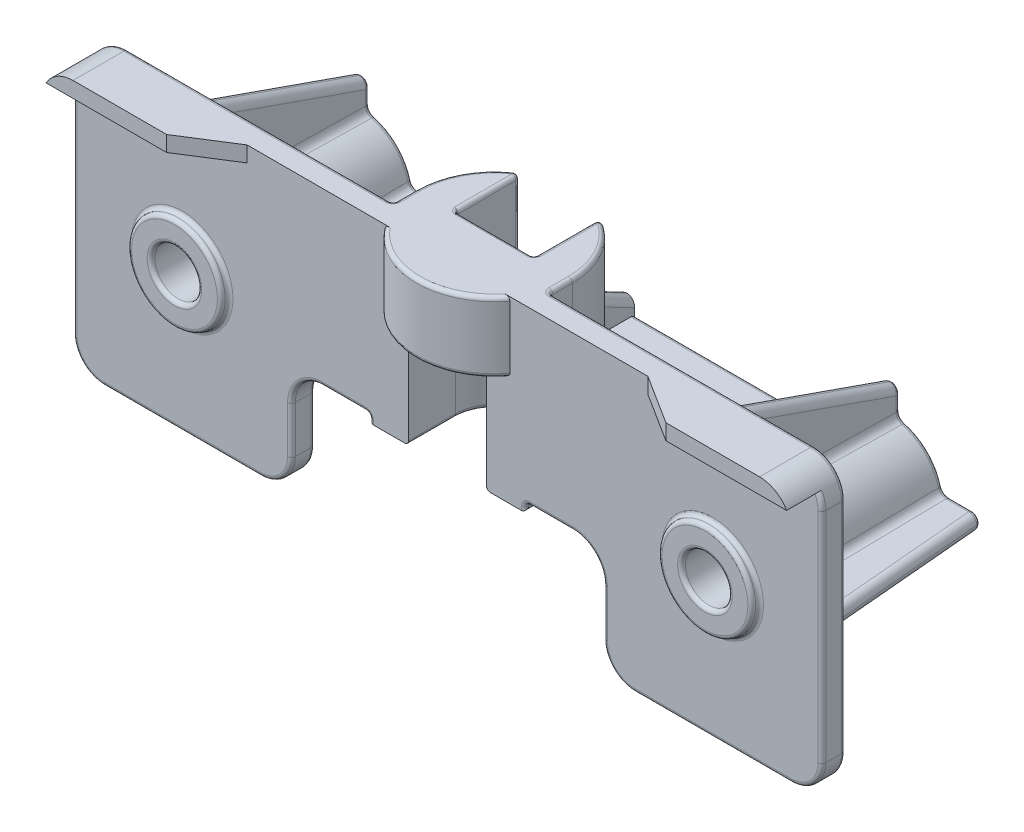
SolidWorks part; units mm, degrees
ref_plane "Face" through (0, 0, 0) normal (0, 0, 1) x (1, 0, 0)
ref_plane "Dessus" through (0, 0, 0) normal (0, 1, 0) x (1, 0, 0)
ref_plane "Droite" through (0, 0, 0) normal (1, 0, 0) x (0, 0, -1)
sketch "Esquisse1" plane through (0, 0, 0) normal (0, 0, 1) x (1, 0, 0)
  line L0 (0, 49.8635) -> (0, -37.2664) construction
  line L1 (-22, 9) -> (22, 9)
  line L2 (12, -9) -> (22, -9)
  line L6 (-24, 7) -> (-24, -7)
  line L7 (24, 7) -> (24, -7)
  line L8 (-22, -9) -> (-12, -9)
  line L9 (0, 0) -> (46.9803, 0) construction
  line L10 (10, -4) -> (10, -7)
  line L11 (-10, -4) -> (-10, -7)
  line L12 (8, -2) -> (-8, -2)
  arc A0 (-24, 7) -> (-22, 9) centre (-22, 7) cw
  arc A5 (24, 7) -> (22, 9) centre (22, 7) ccw
  arc A6 (22, -9) -> (24, -7) centre (22, -7) ccw
  arc A7 (-24, -7) -> (-22, -9) centre (-22, -7) ccw
  arc A8 (10, -7) -> (12, -9) centre (12, -7) ccw
  arc A9 (10, -4) -> (8, -2) centre (8, -4) ccw
  arc A10 (-8, -2) -> (-10, -4) centre (-8, -4) ccw
  arc A11 (-12, -9) -> (-10, -7) centre (-12, -7) ccw
  point P13 (0, -9)
  point P15 (-24, 9)
  point P30 (24, 9)
  point P33 (24, -9)
  point P36 (-24, -9)
  point P51 (0, -2)
  dimension "D6" = 2
  dimension "D2" = 48
  dimension "D3" = 9
  dimension "D4" = 18
extrude "Extrusion1" add sketch "Esquisse1" along normal blind 1.5
sketch "Esquisse2" plane through (0, 0, 0) normal (0, 1, 0) x (1, 0, 0)
  line L0 (-23.5, 0) -> (23.5, 0)
  line L1 (0, 0) -> (0, 12.9762) construction
  line L2 (-23.5, 0) -> (-22.6251, 10)
  line L3 (23.5, 0) -> (22.6251, 10)
  line L4 (-22.6251, 10) -> (22.6251, 10)
  point P10 (0, 10)
  dimension "D1" = 10
  dimension "D2" = 5
  dimension "D3" = 23.5
extrude "Extrusion2" add sketch "Esquisse2" along normal mid plane 1
sketch "Esquisse3" plane through (0, 0, 0) normal (0, 0, -1) x (-1, 0, 0)
  line L0 (0, 0) -> (-28.9554, 0) construction
  line L1 (0, 0) -> (0, 13.9934) construction
  circle A0 centre (-17, 0) radius 3.5
  circle A1 centre (17, 0) radius 3.5
  dimension "D1" = 7
  dimension "D2" = 34
extrude "Extrusion3" add sketch "Esquisse3" along normal up to surface draft 1
sketch "Esquisse4" plane through (0, 0, 1.5) normal (0, 0, 1) x (1, 0, 0)
  line L4 (-16, 9) -> (-16, 8)
  line L5 (22, 9) -> (16, 9)
  line L6 (0, 0) -> (0, 16.398) construction
  line L7 (-16, 9) -> (-22, 9)
  line L8 (23.7321, 8) -> (16, 8)
  line L9 (16, 9) -> (16, 8)
  line L11 (-16, 8) -> (-23.7321, 8)
  arc A2 (23.7321, 8) -> (22, 9) centre (22, 7) ccw
  arc A3 (-22, 9) -> (-23.7321, 8) centre (-22, 7) ccw
  dimension "D2" = 16
  dimension "D3" = 32
  dimension "D1" = 1
extrude "Extrusion4" add sketch "Esquisse4" along normal blind 2
sketch "Esquisse5" plane through (0, 8, 0) normal (0, -1, 0) x (1, 0, 0)
  line L0 (16, 3.5) -> (12.8407, 1.5)
  line L2 (12.8407, 1.5) -> (16, 1.5)
  line L3 (16, 1.5) -> (16, 3.5)
  line L4 (0, 0) -> (0, 14.2244) construction
  line L5 (-16, 1.5) -> (-16, 3.5)
  line L6 (-12.8407, 1.5) -> (-16, 1.5)
  line L7 (-16, 3.5) -> (-12.8407, 1.5)
extrude "Extrusion6" add sketch "Esquisse5" against normal up to surface (1 mm away)
sketch "Esquisse6" plane through (0, 9, 0) normal (0, 1, 0) x (-1, 0, 0)
  line L0 (-12.8407, 1.5) -> (12.8407, 1.5) construction
  line L1 (0, 0) -> (0, -14.3045) construction
  line L2 (-7.1136, -1.5) -> (7.1804, -1.5) construction
  line L4 (4, 1.5) -> (5, 1.5)
  line L5 (5, -1.5) -> (5, 1.5)
  line L6 (-5, -1.5) -> (-5, 1.5)
  line L8 (-5, 1.5) -> (-4, 1.5)
  arc A0 (-5, -1.5) -> (5, -1.5) centre (0, -1.5) ccw
  arc A1 (4, 1.5) -> (-4, 1.5) centre (0, -1.5) ccw
  dimension "D1" = 10
  dimension "D2" = 3
extrude "Extrusion7" add sketch "Esquisse6" against normal blind 11.5
sketch "Esquisse7" plane through (0, -2.5, 0) normal (0, -1, 0) x (1, 0, 0)
  line L0 (5, 1.5) -> (8, 1.5) construction
  line L1 (-7.5812, 6.8026) -> (7.1804, 6.8026)
  line L2 (-7.5812, 6.8026) -> (-7.5812, 1.5)
  line L3 (-7.5812, 1.5) -> (7.1804, 1.5)
  line L4 (7.1804, 6.8026) -> (7.1804, 1.5)
extrude "Enlèv. mat.-Extru.1" cut sketch "Esquisse7" against normal blind 7
sketch "Esquisse8" plane through (0, -2.5, 0) normal (0, -1, 0) x (1, 0, 0)
  line L0 (0, -1.5) -> (0, 11.2778) construction
  line L1 (2.5, -1.5) -> (2.5, 7.2033)
  line L2 (-2.5, -1.5) -> (-2.5, 7.2033)
  line L3 (2.5, 7.2033) -> (-2.5, 7.2033)
  arc A0 (-2.5, -1.5) -> (2.5, -1.5) centre (0, -1.5) ccw
  point P9 (0, 7.2033)
  dimension "D1" = 2.5
extrude "Enlèv. mat.-Extru.2" cut sketch "Esquisse8" against normal blind 7
sketch "Esquisse9" plane through (0, 9, 0) normal (0, 1, 0) x (-1, 0, 0)
  line L0 (0, -1.5) -> (0, -8.6225) construction
  line L1 (-2.5, -1.5) -> (-2.5, -7.4003)
  line L2 (2.5, -1.5) -> (2.5, -7.4003)
  line L3 (-2.5, -7.4003) -> (2.5, -7.4003)
  arc A0 (2.5, -1.5) -> (-2.5, -1.5) centre (0, -1.5) ccw
  arc A1 (-2.5, -1.5) -> (2.5, -1.5) centre (0, -1.5) ccw construction
  point P13 (0, -7.4003)
extrude "Enlèv. mat.-Extru.3" cut sketch "Esquisse9" against normal blind 5
sketch "Esquisse10" plane through (0, 0, 0) normal (1, 0, 0) x (0, 0, -1)
  line L0 (0, 0.5) -> (10, 0.5) construction
  line L1 (5.9849, 0.5) -> (10, 0.5)
  line L2 (5.9849, 0.5) -> (5.9849, 3.5466)
  line L3 (5.9849, 3.5466) -> (10, 1.4425)
  line L4 (10, 0.5) -> (10, 3.3254) construction
  line L5 (10, 0.5) -> (10, 1.4425)
extrude "Extrusion8" add sketch "Esquisse10" along normal mid plane 1
ref_plane "Plan1" through (17, 0, 0) normal (1, 0, 0) x (0, 0, -1)
sketch "Esquisse11" plane through (17, 0, 0) normal (1, 0, 0) x (0, 0, -1)
  line L0 (0, 8.56) -> (0, 3.1823)
  line L1 (0, 7) -> (0, 9) construction
  line L2 (0, -7) -> (0, 7) construction
  line L3 (0, 3.1823) -> (10, 3.1823)
  line L4 (10, 3.1823) -> (10, 5.0543)
  line L5 (10, 5.0543) -> (0, 8.56)
  line L6 (10, 0.5) -> (10, 3.3254) construction
extrude "Extrusion9" add sketch "Esquisse11" along normal mid plane 1
mirror "Symétrie1" about plane through (0, 0, 0) normal (1, 0, 0)
sketch "Esquisse12" plane through (0, 0, 1.5) normal (0, 0, 1) x (1, 0, 0)
  line L0 (0, 0) -> (0, -11.5888) construction
  circle A0 centre (17, 0) radius 3
  circle A1 centre (-17, 0) radius 3
  dimension "D1" = 6
extrude "Extrusion10" add sketch "Esquisse12" along normal blind 0.5
sketch "Esquisse13" plane through (0, 0, 2) normal (0, 0, 1) x (1, 0, 0)
  circle A0 centre (17, 0) radius 1.5
  circle A1 centre (-17, 0) radius 1.5
  dimension "D1" = 3
  dimension "D2" = 3
extrude "Enlèv. mat.-Extru.4" cut sketch "Esquisse13" against normal blind 10
fillet "Congé1" radius 0.5
fillet "Congé2" radius 0.25
fillet "Congé4" radius 0.25
sketch "Esquisse14" plane through (0, 9, 0) normal (0, 1, 0) x (-1, 0, 0)
  line L1 (-2.9056, 1.5258) -> (3.1727, 1.5258)
  line L2 (-2.9056, 1.5258) -> (-2.9056, -1.5)
  line L3 (-2.9056, -1.5) -> (3.1727, -1.5)
  line L4 (3.1727, 1.5258) -> (3.1727, -1.5)
extrude "Extrusion11" add sketch "Esquisse14" against normal blind 1
fillet "Congé6" radius 0.2
fillet "Congé7" radius 0.2
